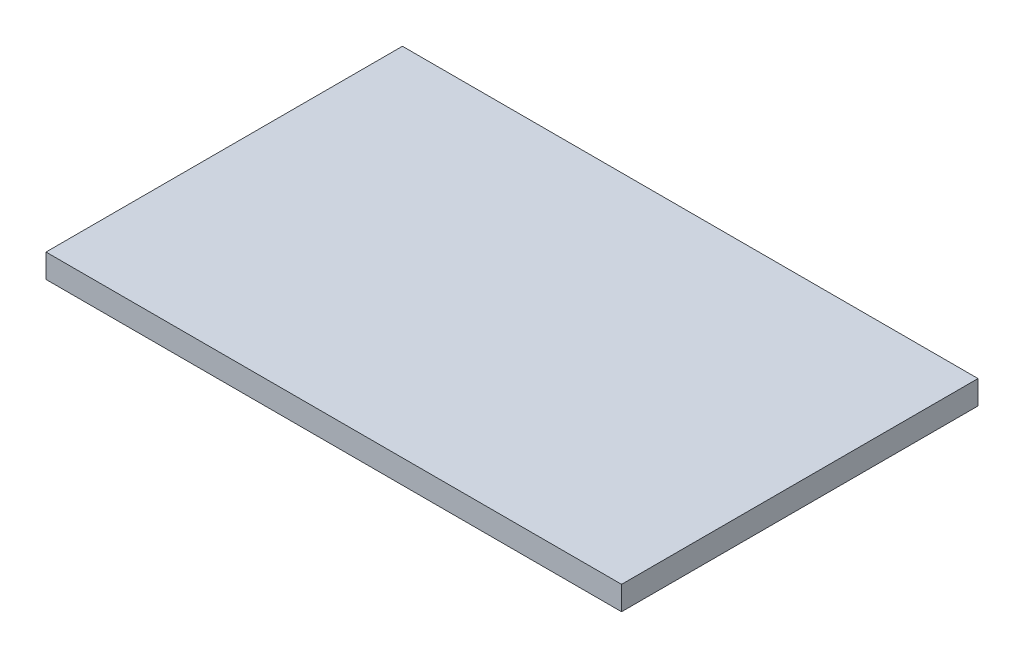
SolidWorks part; units mm, degrees
ref_plane "Front" through (0, 0, 0) normal (0, 0, 1) x (1, 0, 0)
ref_plane "Top" through (0, 0, 0) normal (0, 1, 0) x (1, 0, 0)
ref_plane "Right" through (0, 0, 0) normal (1, 0, 0) x (0, 0, -1)
sketch "Sketch1" plane through (0, 0, 0) normal (0, 1, 0) x (1, 0, 0)
  line L1 (0, 0) -> (121.0966, 0)
  line L2 (0, 0) -> (0, 74.991)
  line L3 (0, 74.991) -> (121.0966, 74.991)
  line L4 (121.0966, 0) -> (121.0966, 74.991)
extrude "Extrude1" add sketch "Sketch1" along normal blind 5
sketch "Sketch2" plane through (0, 5, 0) normal (0, 1, 0) x (-1, 0, 0)
  line L1 (-26.8255, -64.4644) -> (-92.1009, -64.4644)
  line L2 (-16.8255, -54.4644) -> (-16.8255, -25.2039)
  line L3 (-26.8255, -15.2039) -> (-92.1009, -15.2039)
  line L4 (-102.1009, -54.4644) -> (-102.1009, -25.2039)
  arc A0 (-26.8255, -64.4644) -> (-16.8255, -54.4644) centre (-26.8255, -54.4644) ccw
  arc A1 (-92.1009, -64.4644) -> (-102.1009, -54.4644) centre (-92.1009, -54.4644) cw
  arc A2 (-92.1009, -15.2039) -> (-102.1009, -25.2039) centre (-92.1009, -25.2039) ccw
  arc A3 (-16.8255, -25.2039) -> (-26.8255, -15.2039) centre (-26.8255, -25.2039) ccw
  dimension "D1" = 10
